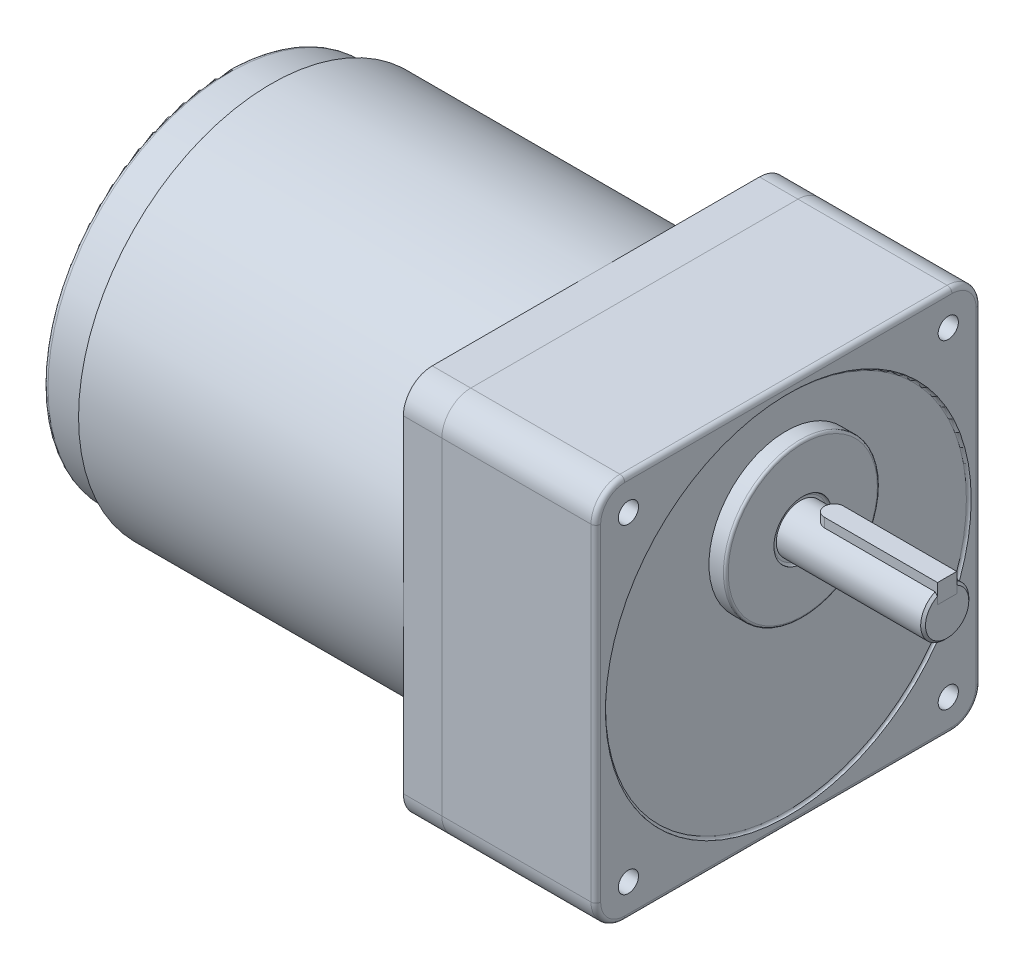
SolidWorks part; units mm, degrees
ref_plane "前视基准面" through (0, 0, 0) normal (0, 0, 1) x (1, 0, 0)
ref_plane "上视基准面" through (0, 0, 0) normal (0, 1, 0) x (1, 0, 0)
ref_plane "右视基准面" through (0, 0, 0) normal (1, 0, 0) x (0, 0, -1)
sketch "草图1" plane through (0, 0, 0) normal (1, 0, 0) x (0, 0, -1)
  line L1 (-34, -40) -> (34, -40)
  line L2 (-40, -34) -> (-40, 34)
  line L3 (-34, 40) -> (34, 40)
  line L4 (40, -34) -> (40, 34)
  line L5 (-40, -40) -> (40, 40) construction
  line L6 (-40, 40) -> (40, -40) construction
  arc A0 (-34, -40) -> (-40, -34) centre (-34, -34) cw
  arc A1 (34, -40) -> (40, -34) centre (34, -34) ccw
  arc A2 (34, 40) -> (40, 34) centre (34, 34) cw
  arc A3 (-40, 34) -> (-34, 40) centre (-34, 34) cw
  point P0 (0, 0)
  dimension "D1" = 6
extrude "凸台-拉伸1" add sketch "草图1" against normal blind 32
sketch "草图2" plane through (-32, 0, 0) normal (-1, 0, 0) x (0, 0, 1)
  line L0 (-34, 40) -> (34, 40) construction
  line L1 (-34, -40) -> (34, -40)
  line L2 (-40, -34) -> (-40, 34)
  line L3 (-34, 40) -> (34, 40)
  line L4 (40, -34) -> (40, 34)
  line L5 (-40, -40) -> (40, 40) construction
  line L6 (-40, 40) -> (40, -40) construction
  arc A0 (-34, -40) -> (-40, -34) centre (-34, -34) cw
  arc A1 (34, -40) -> (40, -34) centre (34, -34) ccw
  arc A2 (34, 40) -> (40, 34) centre (34, 34) cw
  arc A3 (-40, 34) -> (-34, 40) centre (-34, 34) cw
  point P0 (0, 0)
  dimension "D1" = 6
extrude "凸台-拉伸2" add sketch "草图2" along normal blind 8 separate body
sketch "草图3" plane through (-40, 0, 0) normal (-1, 0, 0) x (0, 0, 1)
  circle A0 centre (0, 0) radius 40
extrude "凸台-拉伸3" add sketch "草图3" along normal blind 67.5
sketch "草图4" plane through (-107.5, 0, 0) normal (-1, 0, 0) x (0, 0, 1)
  circle A0 centre (0, 0) radius 37.85
extrude "凸台-拉伸4" add sketch "草图4" along normal blind 9.5
fillet "圆角1" radius 1 1 edges at (-117, 0, 37.85)
fillet "圆角2" radius 1 8 edges at (0, 0, 40) (0, 38.2426, 38.2426) (0, 40, 0) (0, 38.2426, -38.2426) (0, 0, -40) (0, -38.2426, -38.2426) (0, -40, 0) (0, -38.2426, 38.2426)
sketch "草图5" plane through (0, 0, 0) normal (1, 0, 0) x (0, 0, -1)
  point P10 (-33.234, 33.234)
  point P11 (33.234, 33.234)
  point P12 (33.234, -33.234)
  point P13 (-33.234, -33.234)
hole_wizard "M5 螺纹孔1" positions "3D草图1" profile "草图6" tap size "M5" standard "GB"
sketch3d "3D草图1"
  point P0 (0, 33.234, 33.234)
  point P3 (0, -33.234, 33.234)
  point P6 (0, -33.234, -33.234)
  point P9 (0, 33.234, -33.234)
sketch "草图6" plane through (0, 33.234, 33.234) normal (0, 1, 0) x (0, 0, -1)
  line L0 (0, 0) -> (0, 15.2618)
  line L1 (0, 15.2618) -> (2.1, 14)
  line L2 (2.1, 14) -> (2.1, 0)
  line L5 (2.1, 0) -> (0, 0)
  line L10 (0, 15.2618) -> (-2.1, 14) construction
  line L11 (0, -6.35) -> (0, 107.95) construction
  dimension "螺纹孔钻头直径" = 4.2
  dimension "螺纹孔钻头深度" = 14
  dimension "导头角度" = 118
sketch "草图7" plane through (0, 0, 0) normal (1, 0, 0) x (0, 0, -1)
  circle A0 centre (0, 0) radius 38
extrude "切除-拉伸1" cut sketch "草图7" against normal blind 0.5
fillet "圆角3" radius 0.5 1 edges at (-0.5, 0, -38)
sketch "草图8" plane through (-0.5, 0, 0) normal (1, 0, 0) x (0, 0, -1)
  circle A0 centre (0, 15) radius 16
extrude "凸台-拉伸5" add sketch "草图8" along normal blind 3.5
fillet "圆角4" radius 0.5 1 edges at (3, 15, -16)
sketch "草图9" plane through (3, 0, 0) normal (1, 0, 0) x (0, 0, -1)
  circle A0 centre (0, 15) radius 6
extrude "切除-拉伸2" cut sketch "草图9" against normal blind 0.5
fillet "圆角5" radius 0.5 1 edges at (2.5, 15, -6)
sketch "草图10" plane through (2.5, 0, 0) normal (1, 0, 0) x (0, 0, -1)
  circle A0 centre (0, 15) radius 5
extrude "凸台-拉伸6" add sketch "草图10" along normal blind 30.5
ref_plane "基准面1" through (0, 20, 0) normal (0, 1, 0) x (1, 0, 0)
sketch "草图11" plane through (0, 20, 0) normal (0, 1, 0) x (1, 0, 0)
  line L1 (33, -5) -> (33, 5) construction
  line L2 (9.5, 2) -> (33, 2)
  line L3 (33, 2) -> (33, -2)
  line L4 (33, -2) -> (9.5, -2)
  arc A0 (9.5, 2) -> (9.5, -2) centre (9.5, 0) ccw
extrude "切除-拉伸3" cut sketch "草图11" against normal blind 2.5
sketch "草图12" plane through (0, 17.5, 0) normal (0, 1, 0) x (1, 0, 0)
  line L0 (9.5, 2) -> (33, 2)
  line L1 (33, 2) -> (33, -2)
  line L2 (33, -2) -> (9.5, -2)
  arc A0 (9.5, 2) -> (9.5, -2) centre (9.5, 0) ccw
extrude "凸台-拉伸7" add sketch "草图12" along normal blind 4 separate body
chamfer "倒角1" distance 0.5 angle 45 1 edges at (33, 10, 0)
